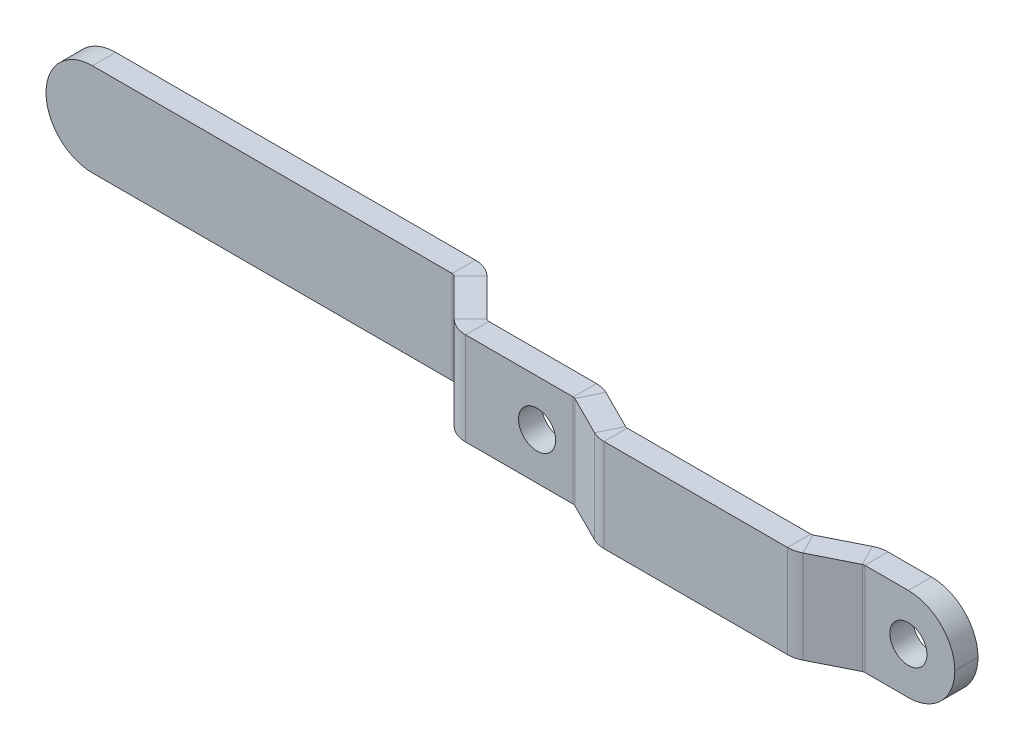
SolidWorks part; units mm, degrees
ref_plane "Plane1" through (0, 0, 0) normal (0, 0, 1) x (1, 0, 0)
ref_plane "Plane2" through (0, 0, 0) normal (0, 1, 0) x (-1, 0, 0)
ref_plane "Plane3" through (0, 0, 0) normal (1, 0, 0) x (0, 0, -1)
sketch "Sketch2" plane through (0, 0, 0) normal (0, 1, 0) x (-1, 0, 0)
  line L0 (0, 0) -> (13.208, 0)
  line L1 (13.208, 0) -> (19.558, 3.175)
  line L2 (19.558, 3.175) -> (44.958, 3.175)
  line L3 (44.958, 3.175) -> (51.308, 0)
  line L4 (51.308, 0) -> (67.183, 0)
  line L5 (67.183, 0) -> (73.533, -6.35)
  line L6 (73.533, -6.35) -> (130.683, -6.35)
  line L7 (0, 3.175) -> (12.4585, 3.175)
  line L8 (12.4585, 3.175) -> (18.8085, 6.35)
  line L9 (18.8085, 6.35) -> (45.7075, 6.35)
  line L10 (45.7075, 6.35) -> (52.0575, 3.175)
  line L11 (52.0575, 3.175) -> (68.4981, 3.175)
  line L12 (68.4981, 3.175) -> (74.8481, -3.175)
  line L13 (74.8481, -3.175) -> (130.683, -3.175)
  line L14 (0, 0) -> (0, 3.175)
  line L15 (130.683, -6.35) -> (130.683, -3.175)
  dimension "D1" = 13.208
  dimension "D2" = 6.35
  dimension "D3" = 25.4
  dimension "D4" = 6.35
  dimension "D5" = 15.875
  dimension "D6" = 6.35
  dimension "D7" = 57.15
  dimension "D8" = 3.175
  dimension "D9" = 6.35
  dimension "D10" = 3.175
  dimension "D11" = 3.175
  dimension "D12" = 3.175
  dimension "D13" = 3.175
  dimension "D14" = 3.175
  dimension "D15" = 3.175
  dimension "D16" = 3.175
extrude "Base-Extrude" add sketch "Sketch2" along normal blind 12.7
fillet "Inside bend radius" radius 0.635 6 edges at (-19.558, 6.35, 3.175) (-44.958, 6.35, 3.175) (-67.183, 6.35, 0) (-74.8481, 6.35, -3.175) (-52.0575, 6.35, 3.175) (-12.4585, 6.35, 3.175)
fillet "Outside bend radius" radius 3.81 6 edges at (-13.208, 6.35, 0) (-51.308, 6.35, 0) (-73.533, 6.35, -6.35) (-68.4981, 6.35, 3.175) (-45.7075, 6.35, 6.35) (-18.8085, 6.35, 6.35)
fillet "Round ends" radius 6.35 8 edges at (-130.683, 0, -4.7625) (0, 0, 1.5875) (0, 6.35, 0) (-130.683, 6.35, -6.35) (-130.683, 6.35, -3.175) (0, 6.35, 3.175) (-130.683, 12.7, -4.7625) (0, 12.7, 1.5875)
sketch "Sketch3" plane through (0, 0, 3.175) normal (0, 0, 1) x (1, 0, 0)
  line L0 (-6.35, 6.35) -> (-91.0855, 6.35) construction
  circle A0 centre (-6.35, 6.35) radius 2.54
  circle A1 centre (-57.15, 6.35) radius 2.54
  arc A2 (0, 6.35) -> (-6.35, 12.7) centre (-6.35, 6.35) ccw construction
  dimension "D2" = 5.08
  dimension "D1" = 50.8
extrude "Holes" cut sketch "Sketch3" against normal through all
sheet metal parameters "Sheet-Metal1" thickness 3.175 parameters "D1"=0
bend "RoundBend6" bend radius 0.635 bend angle 45 parameters "D5"=1
flatten bends "Flatten-Bends1" parameters "D1"=0
sketch "Sharp-Sketch1" plane through (0, 0, -3.175) normal (0, 0, 1) x (1, 0, 0)
  line L0 (-74.2384, 0) -> (-74.2384, 12.7) construction
  line L1 (-65.3538, 12.7) -> (-65.3538, 0) construction
  line L2 (-49.2532, 0) -> (-49.2532, 12.7) construction
  line L3 (-42.1725, 12.7) -> (-42.1725, 0) construction
  line L4 (-16.0419, 12.7) -> (-16.0419, 0) construction
  line L5 (-8.9612, 0) -> (-8.9612, 12.7) construction
bend "RoundBend1" bend radius 0.635 bend angle 26.565 parameters "D5"=6
bend "RoundBend2" bend radius 0.635 bend angle 26.565 parameters "D5"=5
bend "RoundBend3" bend radius 0.635 bend angle 26.565 parameters "D5"=4
bend "RoundBend4" bend radius 0.635 bend angle 26.565 parameters "D5"=3
bend "RoundBend5" bend radius 0.635 bend angle 45 parameters "D5"=2
process bends "Process-Bends1" parameters "D1"=0
sketch "Flat-Sketch1" plane through (0, 0, -3.175) normal (0, 0, 1) x (1, 0, 0)
equation "\"D10@Sketch2\" = \"D11@Sketch2\""
equation "\"D12@Sketch2\" = \"D10@Sketch2\""
equation "\"D13@Sketch2\" = \"D10@Sketch2\""
equation "\"D14@Sketch2\" = \"D10@Sketch2\""
equation "\"D15@Sketch2\" = \"D10@Sketch2\""
equation "\"D16@Sketch2\" = \"D10@Sketch2\""
